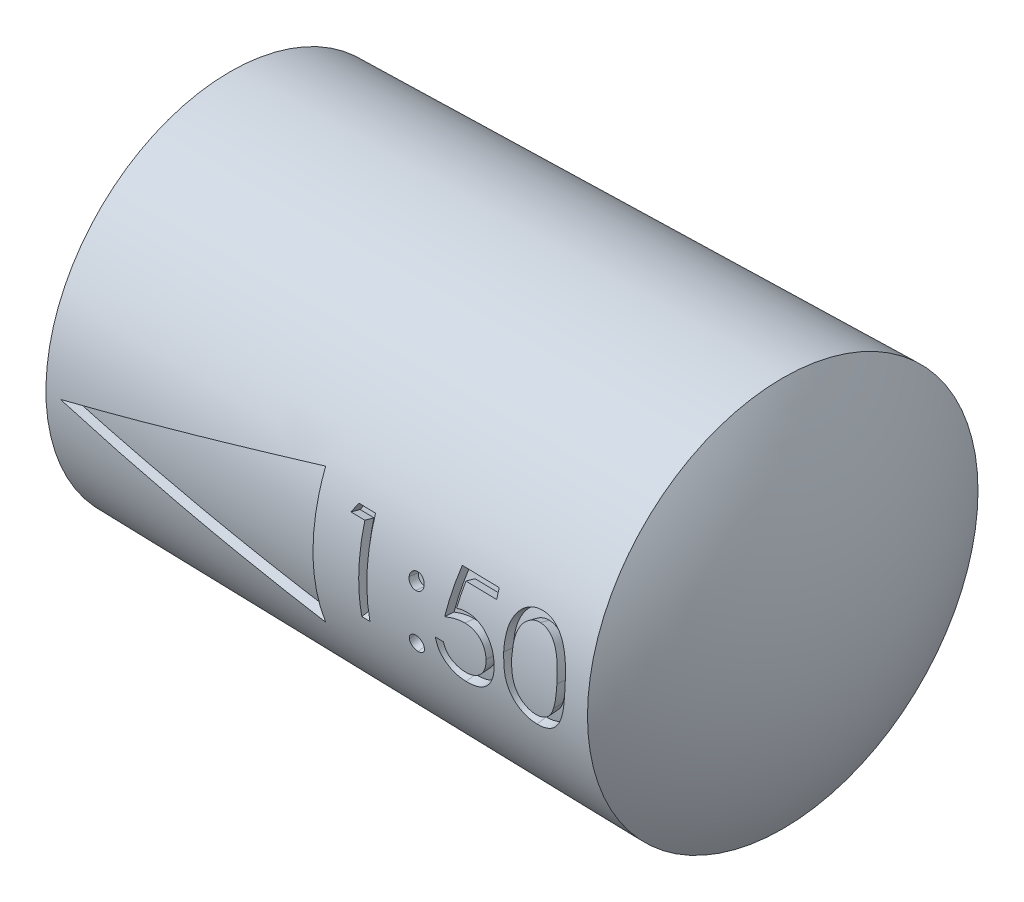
SolidWorks part; units mm, degrees
ref_plane "Front Plane" through (0, 0, 0) normal (0, 0, 1) x (1, 0, 0)
ref_plane "Top Plane" through (0, 0, 0) normal (0, 1, 0) x (1, 0, 0)
ref_plane "Right Plane" through (0, 0, 0) normal (1, 0, 0) x (0, 0, -1)
sketch "Sketch1" plane through (0, 0, 0) normal (1, 0, 0) x (0, 0, -1)
  circle A0 centre (0, 0) radius 2
  dimension "D1" = 4
extrude "Extrude1" add sketch "Sketch1" along normal mid plane 6
draft "Draft1" type of draft neutral plane draft angle 1.146 faces to draft 1 parameters "D1"=1.146
sketch "Sketch2" plane through (0, 0, 0) normal (0, 0, 1) x (1, 0, 0)
  line L0 (-3, 0) -> (-3, 2)
  line L1 (-3, 2) -> (-3, -2) construction
  line L2 (-3, 0) -> (-3.6, 0)
  line L3 (-3.6, 0) -> (-3.6, -2.06) construction
  line L4 (3, 0) -> (3, 2.12)
  line L5 (3, -2.12) -> (3, 2.12) construction
  line L6 (3, 0) -> (3.6, 0)
  line L7 (3.6, 0) -> (3.6, -2.06) construction
  line L8 (-3, -2) -> (3, -2.12) construction
  arc A0 (-3.6, 0) -> (-3, 2) centre (0.0333, 0) cw
  arc A1 (3.6, 0) -> (3, 2.12) centre (-0.4453, 0) ccw
  point P14 (0, -2.06)
revolve "Revolve1" add sketch "Sketch2" angle 360 about L2
sketch "Sketch5" plane through (0, 0, 0) normal (0, 0, 1) x (1, 0, 0)
  line L0 (0, 2.06) -> (0, -2.06) construction
  line L1 (3, 2.12) -> (-3, 2) construction
  line L2 (-3, -2) -> (3, -2.12) construction
ref_plane "Plane2" through (0, 0, 0) normal (-0.02, 0, 0.9998) x (0.9998, 0, 0.02)
sketch "Sketch6" plane through (0, 0, 0) normal (-0.02, 0, 0.9998) x (0.9998, 0, 0.02)
  line L0 (0, 0) -> (0, 0.75)
  line L1 (0, 2.06) -> (0, -2.06) construction
  line L2 (0, 0.75) -> (-2.799, 0)
  line L3 (-2.799, 0) -> (0, -0.75)
  line L4 (0, -0.75) -> (0, 0)
  line L5 (0, -0.375) -> (3, -0.375) construction
  text T0 "1:50" font "Century Gothic" height 1
  dimension "D1" = 1.5
  dimension "D2" = 30
  dimension "D3" = 3
wrap "Wrap2" sketch "Sketch6" wrap type deboss source sketch "Sketch6" thickness 0.1 parameters "D1"=0.1
equation "\"D2@Sketch2\" = \"D1@Sketch2\""
